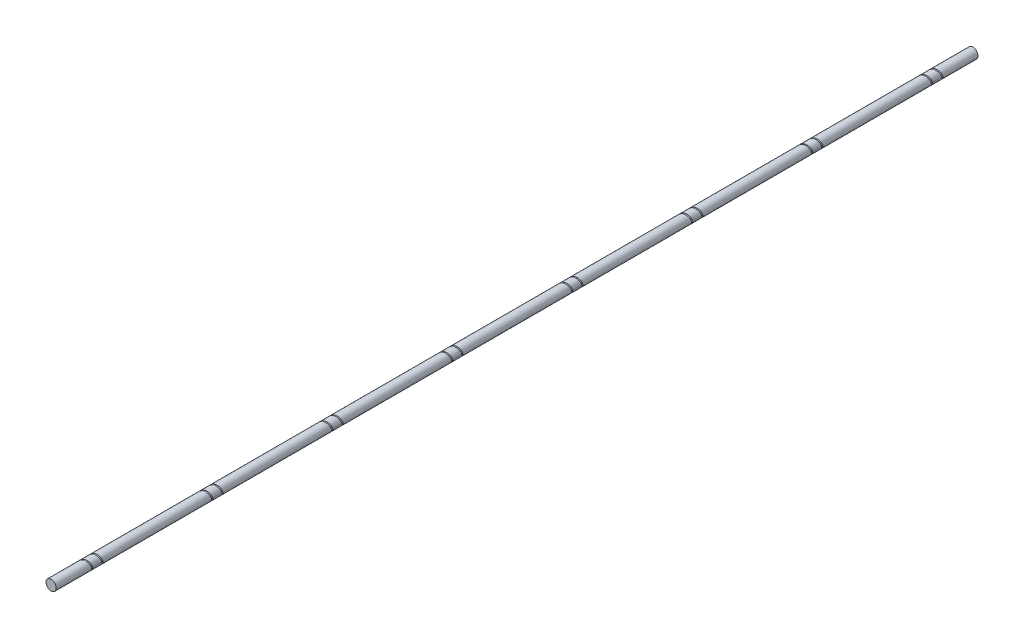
SolidWorks part; units mm, degrees
ref_plane "Front Plane" through (0, 0, 0) normal (0, 0, 1) x (1, 0, 0)
ref_plane "Top Plane" through (0, 0, 0) normal (0, 1, 0) x (1, 0, 0)
ref_plane "Right Plane" through (0, 0, 0) normal (1, 0, 0) x (0, 0, -1)
sketch "Sketch1" plane through (0, 0, 0) normal (0, 0, 1) x (1, 0, 0)
  circle A0 centre (0, 0) radius 25
  dimension "D1" = 50
extrude "Boss-Extrude1" add sketch "Sketch1" along normal blind 4500
ref_plane "Plane1" through (0, 0, 150) normal (0, 0, 1) x (1, 0, 0)
sketch "Sketch2" plane through (0, 0, 150) normal (0, 0, 1) x (1, 0, 0)
  circle A0 centre (0, 0) radius 27.646
  dimension "D1" = 55.292
curve "Helix/Spiral1"
sketch "Sketch3" plane through (0, 0, 0) normal (0, 1, 0) x (1, 0, 0)
  circle A0 centre (-27.646, -150) radius 3.969
  spline S0 degree 3 poles (-27.646, -150) (-27.646, -150.7073) (-26.9833, -152.1286) (-24.0718, -154.2551) (-19.4496, -156.383) (-13.4454, -158.5106) (-6.4857, -160.6383) (0.9349, -162.766) (8.289, -164.8936) (15.0541, -167.0213) (20.7495, -169.1489) (24.9703, -171.2766) (27.4167, -173.4043) (27.9149, -175.5319) (26.4293, -177.6596) (23.0657, -179.7872) (18.063, -181.9149) (11.7766, -184.0426) (4.6535, -186.1702) (-2.8004, -188.2979) (-10.0553, -190.4255) (-16.5956, -192.5532) (-21.9566, -194.6809) (-25.7573, -196.8085) (-27.7277, -198.9362) (-27.7277, -201.0638) (-25.7573, -203.1915) (-21.9566, -205.3191) (-16.5956, -207.4468) (-10.0553, -209.5745) (-2.8004, -211.7021) (4.6535, -213.8298) (11.7766, -215.9574) (18.063, -218.0851) (23.0657, -220.2128) (26.4293, -222.3404) (27.9149, -224.4681) (27.4167, -226.5957) (24.9703, -228.7234) (20.7495, -230.8511) (15.0541, -232.9787) (8.289, -235.1064) (0.9349, -237.234) (-6.4857, -239.3617) (-13.4454, -241.4894) (-19.4496, -243.617) (-24.0718, -245.7449) (-26.9833, -247.8714) (-27.646, -249.2927) (-27.646, -250) knots 0 0 0 0 0.021277 0.042553 0.06383 0.085106 0.106383 0.12766 0.148936 0.170213 0.191489 0.212766 0.234043 0.255319 0.276596 0.297872 0.319149 0.340426 0.361702 0.382979 0.404255 0.425532 0.446809 0.468085 0.489362 0.510638 0.531915 0.553191 0.574468 0.595745 0.617021 0.638298 0.659574 0.680851 0.702128 0.723404 0.744681 0.765957 0.787234 0.808511 0.829787 0.851064 0.87234 0.893617 0.914894 0.93617 0.957447 0.978723 1 1 1 1 construction
  dimension "D1" = 7.938
sweep "Cut-Sweep1" cut profiles "Sketch3" path "Helix/Spiral1"
pattern_linear "LPattern1" count 8 spacing 585.7143 along (0, 0, -1) of "Cut-Sweep1"
